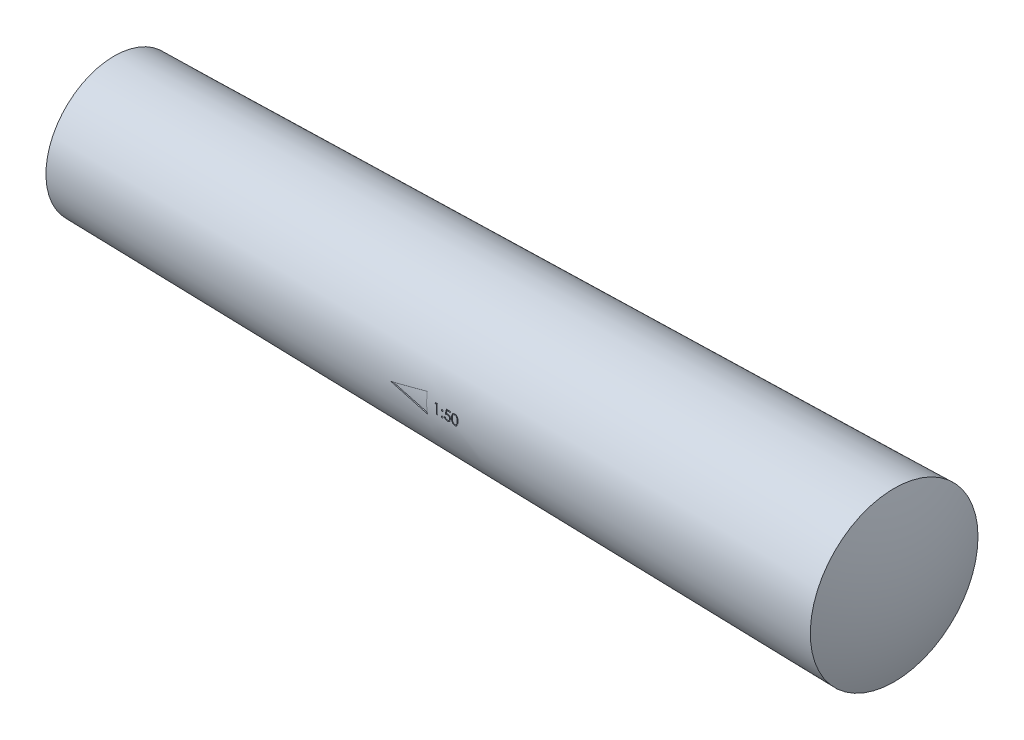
SolidWorks part; units mm, degrees
ref_plane "Front Plane" through (0, 0, 0) normal (0, 0, 1) x (1, 0, 0)
ref_plane "Top Plane" through (0, 0, 0) normal (0, 1, 0) x (1, 0, 0)
ref_plane "Right Plane" through (0, 0, 0) normal (1, 0, 0) x (0, 0, -1)
sketch "Sketch1" plane through (0, 0, 0) normal (1, 0, 0) x (0, 0, -1)
  circle A0 centre (0, 0) radius 7
  dimension "D1" = 14
extrude "Extrude1" add sketch "Sketch1" along normal mid plane 80
draft "Draft1" type of draft neutral plane draft angle 1.146 faces to draft 1 parameters "D1"=1.146
sketch "Sketch2" plane through (0, 0, 0) normal (0, 0, 1) x (1, 0, 0)
  line L0 (-40, 0) -> (-40, 7)
  line L1 (-40, 7) -> (-40, -7) construction
  line L2 (-40, 0) -> (-41.6, 0)
  line L3 (-41.6, 0) -> (-41.6, -7.8) construction
  line L4 (40, 0) -> (40, 8.6001)
  line L5 (40, -8.6001) -> (40, 8.6001) construction
  line L6 (40, 0) -> (41.6, 0)
  line L7 (41.6, 0) -> (41.6, -7.8) construction
  line L8 (-40, -7) -> (40, -8.6001) construction
  arc A0 (-41.6, 0) -> (-40, 7) centre (-25.4875, 0) cw
  arc A1 (41.6, 0) -> (40, 8.6001) centre (17.6872, 0) ccw
  point P14 (0, -7.8)
revolve "Revolve1" add sketch "Sketch2" angle 360 about L2
sketch "Sketch5" plane through (0, 0, 0) normal (0, 0, 1) x (1, 0, 0)
  line L0 (0, 7.8) -> (0, -7.8) construction
  line L1 (40, 8.6001) -> (-40, 7) construction
  line L2 (-40, -7) -> (40, -8.6001) construction
ref_plane "Plane2" through (0, 0, 0) normal (-0.02, 0, 0.9998) x (0.9998, 0, 0.02)
sketch "Sketch6" plane through (0, 0, 0) normal (-0.02, 0, 0.9998) x (0.9998, 0, 0.02)
  line L0 (0, 0) -> (0, 1)
  line L1 (0, 7.8) -> (0, -7.8) construction
  line L2 (0, 1) -> (-3.7321, 0)
  line L3 (-3.7321, 0) -> (0, -1)
  line L4 (0, -1) -> (0, 0)
  line L5 (0, -0.5) -> (4, -0.5) construction
  text T0 "1:50" font "Century Gothic" height 1
  dimension "D1" = 2
  dimension "D2" = 30
  dimension "D3" = 4
wrap "Wrap2" sketch "Sketch6" wrap type deboss source sketch "Sketch6" thickness 0.1 parameters "D1"=0.1
equation "\"D2@Sketch2\" = \"D1@Sketch2\""
